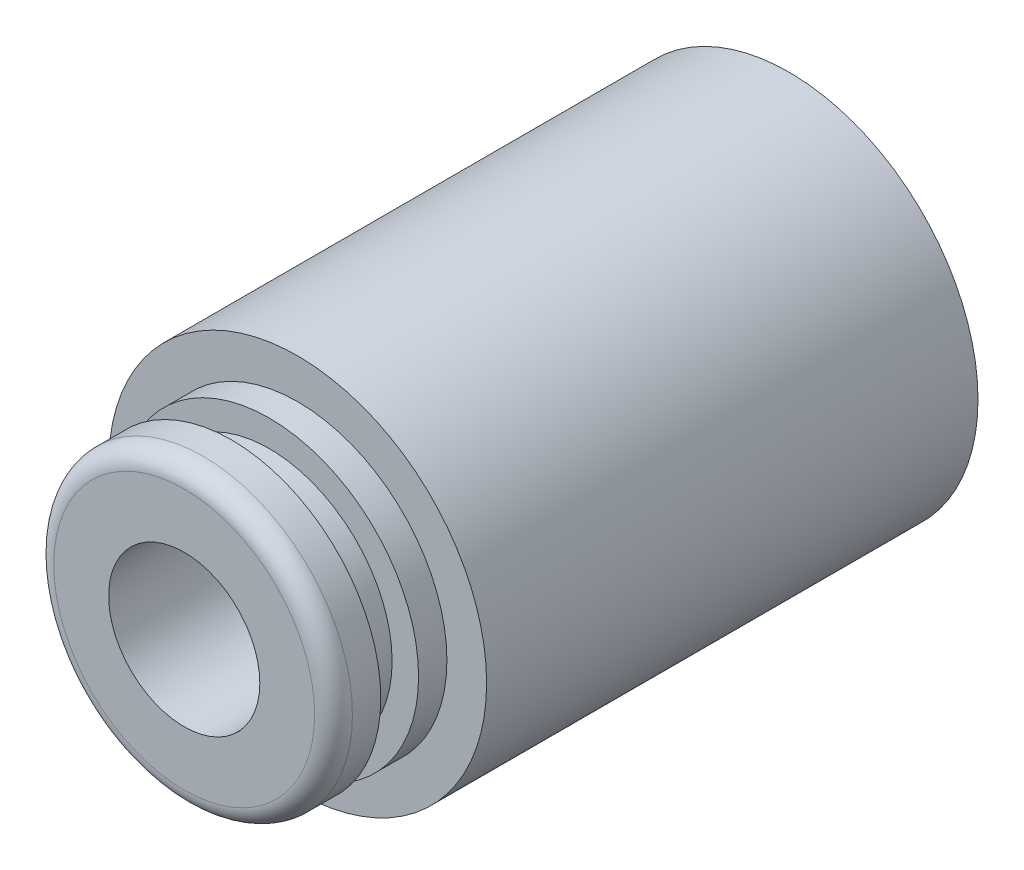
SolidWorks part; units mm, degrees
ref_plane "Plane1" through (0, 0, 0) normal (0, 0, 1) x (1, 0, 0)
ref_plane "Plane2" through (0, 0, 0) normal (0, 1, 0) x (1, 0, 0)
ref_plane "Plane3" through (0, 0, 0) normal (1, 0, 0) x (0, 0, -1)
sketch "Sketch1" plane through (0, 0, 0) normal (0, 0, 1) x (1, 0, 0)
  circle A0 centre (0, 0) radius 5
  circle A1 centre (0, 0) radius 2
  dimension "insert dia" = 10
  dimension "tube dia" = 4
extrude "Insert" add sketch "Sketch1" along normal blind 13
sketch "Sketch2" plane through (0, 0, 13) normal (0, 0, 1) x (1, 0, 0)
  circle A0 centre (0, 0) radius 3.95
  circle A1 centre (0, 0) radius 2 construction
  circle A2 centre (0, 0) radius 2
  dimension "chuck shoulder dia" = 7.9
extrude "chuck shoulder" add sketch "Sketch2" along normal blind 0.75
sketch "Sketch4" plane through (0, 0, 13.75) normal (0, 0, 1) x (1, 0, 0)
  circle A0 centre (0, 0) radius 3.25
  circle A1 centre (0, 0) radius 2 construction
  circle A2 centre (0, 0) radius 2
  dimension "chuck minor dia" = 6.5
extrude "chuck minor dia" add sketch "Sketch4" along normal blind 1
sketch "Sketch5" plane through (0, 0, 14.75) normal (0, 0, 1) x (1, 0, 0)
  circle A0 centre (0, 0) radius 2 construction
  circle A1 centre (0, 0) radius 2
  circle A2 centre (0, 0) radius 3.95 construction
  circle A3 centre (0, 0) radius 3.95
extrude "chuck top" add sketch "Sketch5" along normal blind 1.25
fillet "chuck top fillet" radius 0.5
sketch "Sketch6" plane through (0, 0, 0) normal (0, 0, -1) x (-1, 0, 0)
  circle A0 centre (0, 0) radius 5
  circle A1 centre (0, 0) radius 10.8242
  dimension "D1" = 10
  dimension "D2" = 21.6485
extrude "Cut-Extrude1" cut sketch "Sketch6" against normal blind 13.5
sketch "Sketch7" plane through (0, 0, 15.1) normal (0, 0, 1) x (1, 0, 0)
  circle A0 centre (0, 0) radius 3 construction
  circle A1 centre (0, 0) radius 3
  circle A2 centre (0, 0) radius 4.7
  dimension "D1" = 7.5
extrude "elbow1" add sketch "Sketch7" along normal blind 2.14
ref_plane "Plane4" through (0, 0, 8.14) normal (0, 0, 1) x (1, 0, 0)
sketch "Sketch11" plane through (0, 0, 8.14) normal (0, 0, 1) x (1, 0, 0)
  line L0 (5.2, 0) -> (5.2, 15)
  line L1 (-5.2, 0) -> (-5.2, 15)
  line L2 (5.2, 15) -> (-5.2, 15)
  line L3 (-5.2, 0) -> (5.2, 0)
  dimension "D1" = 15
  dimension "D2" = 10.4
extrude "elbow box" add sketch "Sketch11" along normal blind 24
sketch "Sketch12" plane through (0, 0, 29.5) normal (0, 0, 1) x (1, 0, 0)
  line L1 (0, 0) -> (-4.7, 0)
  line L2 (0, 0) -> (0, -6.2365) construction
  line L3 (0, 0) -> (0, -4.7)
  arc A0 (-4.7, 0) -> (4.7, 0) centre (0, 0) ccw construction
  arc A1 (-4.7, 0) -> (0, -4.7) centre (0, 0) ccw
revolve "Boss-Revolve1" add sketch "Sketch12" angle 360 about L2
ref_plane "Plane5" through (0, 0, 25.14) normal (0, 0, 1) x (1, 0, 0)
sketch "Sketch14" plane through (0, 0, 48) normal (0, 0, 1) x (1, 0, 0)
  line L1 (-4.7, 0) -> (4.7, 0) construction
  line L2 (0, -24.0553) -> (0, 4.3854) construction
  line L3 (-4.7, 0) -> (-4.7, -15)
  line L4 (-4.7, 0) -> (0, 0)
  line L5 (0, 0) -> (0, -15)
  line L6 (-4.7, -15) -> (0, -15)
  dimension "D1" = 11
revolve "elbow3" add sketch "Sketch14" angle 360 about L2
sketch "Sketch15" plane through (0, 0, 48) normal (0, 0, 1) x (1, 0, 0)
  line L2 (-4.7, -15) -> (4.7, -15) construction
  line L3 (-4.7, -15) -> (4.7, -15) construction
  circle A0 centre (0, -15) radius 4.7
extrude "elbow4" add sketch "Sketch15" against normal up to surface (32.9 mm away)
sketch "Sketch16" plane through (0, 0, 48) normal (0, 0, 1) x (1, 0, 0)
  line L0 (-4.7, -15) -> (4.7, -15) construction
  line L2 (0, -15) -> (0, -29.5248) construction
  line L3 (-4.7, -15) -> (0, -15)
  line L4 (0, -15) -> (0, -19.7)
  arc A1 (-4.7, -15) -> (4.7, -15) centre (0, -15) ccw construction
  arc A2 (-4.7, -15) -> (0, -19.7) centre (0, -15) ccw
revolve "elbow6" add sketch "Sketch16" angle 360 about L2
sketch "Sketch18" plane through (0, 18.5, 0) normal (0, 1, 0) x (-1, 0, 0)
  circle A0 centre (0, 48) radius 6.75
  circle A1 centre (0, 48) radius 4.7 construction
  circle A2 centre (0, 48) radius 4
  dimension "hor. chuck shoulder" = 10
  dimension "hor. chuck fitting dia." = 7.9
extrude "hor. chuck shoulder" add sketch "Sketch18" along normal blind 0.75
sketch "Sketch19" plane through (0, 19.25, 0) normal (0, 1, 0) x (-1, 0, 0)
  line L1 (0, 15.1) -> (0, 48) construction
  circle A0 centre (0, 48) radius 4.5
  circle A1 centre (0, 48) radius 4 construction
  circle A2 centre (0, 48) radius 4
  dimension "hor. chuck minor dia." = 6.5
extrude "hor. chuck minor dia" add sketch "Sketch19" along normal blind 1
sketch "Sketch20" plane through (0, 20.25, 0) normal (0, 1, 0) x (-1, 0, 0)
  line L0 (0, 15.1) -> (0, 48) construction
  circle A0 centre (0, 48) radius 6.75
  circle A1 centre (0, 48) radius 4 construction
  circle A2 centre (0, 48) radius 4
  circle A4 centre (0, 48) radius 6.75 construction
extrude "hor. chuck top" add sketch "Sketch20" along normal blind 1.25
fillet "Fillet1" radius 0.5
pattern_linear "hor. chuck pattern" count 11 spacing 11
pattern_linear "LPattern1" count 2 spacing 11
sketch "Sketch23" plane through (0, 0, 0) normal (0, -1, 0) x (1, 0, 0)
  circle A0 centre (0, 48) radius 4.7 construction
  circle A3 centre (0, 48) radius 4
  dimension "D1" = 4.5
extrude "hor. chuck insert" cut sketch "Sketch23" against normal through all
sketch "Sketch26" plane through (0, 0, 0) normal (0, -1, 0) x (1, 0, 0)
  circle A0 centre (0, 29.5) radius 4
  arc A1 (4.7, 29.5) -> (-4.7, 29.5) centre (0, 29.5) ccw construction
  dimension "D1" = 6.8105
extrude "hor. chuck insert 2" cut sketch "Sketch26" against normal through all
sketch "Sketch27" plane through (0, 0, 0) normal (0, 0, 1) x (1, 0, 0)
  circle A0 centre (0, 0) radius 0.5
  dimension "D1" = 1
extrude "solid plug" add sketch "Sketch27" along normal blind 16.8
chamfer "Chamfer1" distance 0.5 angle 45
